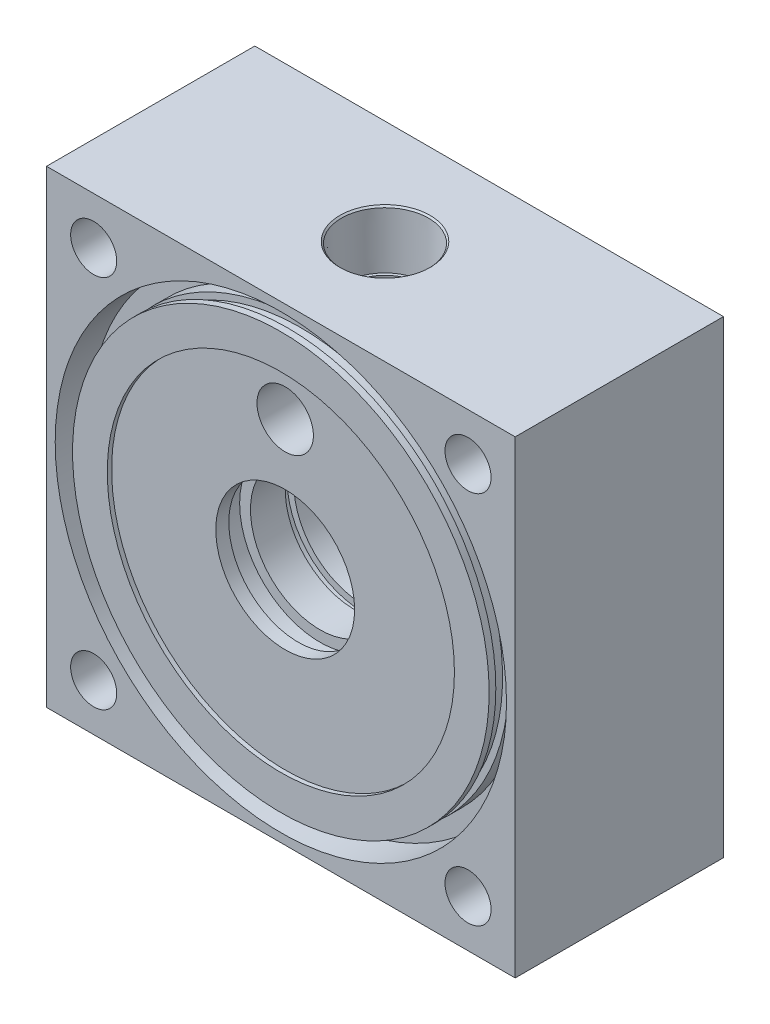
SolidWorks part; units mm, degrees
ref_plane "Front Plane" through (0, 0, 0) normal (0, 0, 1) x (1, 0, 0)
ref_plane "Top Plane" through (0, 0, 0) normal (0, 1, 0) x (1, 0, 0)
ref_plane "Right Plane" through (0, 0, 0) normal (1, 0, 0) x (0, 0, -1)
sketch "Sketch1" plane through (0, 0, 0) normal (0, 0, 1) x (1, 0, 0)
  line L0 (-42.8625, 42.8625) -> (42.8625, -42.8625) construction
  line L1 (-42.8625, -42.8625) -> (42.8625, -42.8625)
  line L2 (-42.8625, -42.8625) -> (-42.8625, 42.8625)
  line L3 (-42.8625, 42.8625) -> (42.8625, 42.8625)
  line L4 (42.8625, -42.8625) -> (42.8625, 42.8625)
  dimension "D2" = 85.725
extrude "Extrude1" add sketch "Sketch1" along normal blind 38.1
sketch "Sketch2" plane through (0, 0, 38.1) normal (0, 0, 1) x (1, 0, 0)
  circle A0 centre (0, 0) radius 38.1
  circle A1 centre (0, 0) radius 41.275
  dimension "D1" = 76.2
  dimension "D2" = 3.175
extrude "Cut-Extrude1" cut sketch "Sketch2" against normal blind 6.35
sketch "Sketch3" plane through (0, 0, 38.1) normal (0, 0, 1) x (1, 0, 0)
  line L0 (-42.8625, -42.8625) -> (42.8625, 42.8625) construction
  line L1 (-42.8625, 42.8625) -> (42.8625, -42.8625) construction
  circle A0 centre (32.8341, 32.8341) radius 4.3656
  circle A1 centre (-32.8341, 32.8341) radius 4.3656
  circle A2 centre (-32.8341, -32.8341) radius 4.3656
  circle A3 centre (32.8341, -32.8341) radius 4.3656
  circle A4 centre (0, 0) radius 46.4344 construction
  circle A5 centre (0, 0) radius 41.275 construction
  dimension "D1" = 8.7312
  dimension "D2" = 5.1594
hole_wizard "3/8 NPT Tapped Hole1" positions "Sketch5" profile "Sketch4" size "3/8" standard "Ansi Inch"
sketch "Sketch5" plane through (0, 42.8625, 0) normal (0, 1, 0) x (-1, 0, 0)
  line L0 (-42.8625, 0) -> (42.8625, 0) construction
  line L1 (42.8625, 38.1) -> (42.8625, 0) construction
  point P0 (0, 19.05)
  point P4 (0, 0)
  point P7 (42.8625, 19.05)
sketch "Sketch4" plane through (0, 42.8625, 19.05) normal (1, 0, 0) x (0, 0, 1)
  line L0 (0, 0) -> (0, 23.3386)
  line L1 (7.1374, 19.05) -> (0, 23.3386)
  line L2 (-7.1374, 19.05) -> (0, 23.3386) construction
  line L3 (7.1374, 19.05) -> (7.1374, 10.414)
  line L4 (7.1374, 10.414) -> (7.6624, 10.414)
  line L5 (7.6624, 10.414) -> (7.9655, 0.2895)
  line L6 (7.9655, 0.2895) -> (8.255, 0)
  line L7 (8.255, 0) -> (0, 0)
  line L8 (0, -6.35) -> (0, 107.95) construction
  line L9 (-7.9655, 0.2895) -> (-8.255, 0) construction
  line L11 (-7.1374, 10.414) -> (-7.6624, 10.414) construction
  line L12 (-7.6624, 10.414) -> (-7.9655, 0.2895) construction
  dimension "Tap Drill Dia." = 14.2748
  dimension "Tap Drill Depth" = 19.05
  dimension "Thread Dia." = 15.9311
  dimension "Thread Angle" = 3.43
  dimension "Thread Depth" = 10.414
  dimension "C'Sink Dia." = 16.51
  dimension "C'Sink Angle" = 90
  dimension "Drill Angle" = 118
sketch "Sketch9" plane through (0, 0, 38.1) normal (0, 0, 1) x (1, 0, 0)
  circle A1 centre (0, 0) radius 31.75
  circle A2 centre (0, 0) radius 38.1 construction
  dimension "D1" = 6.35
extrude "Cut-Extrude3" cut sketch "Sketch9" against normal blind 0.7937
sketch "Sketch10" plane through (0, 0, 38.1) normal (0, 0, 1) x (1, 0, 0)
  circle A0 centre (0, 0) radius 12.7
  dimension "D1" = 25.4
extrude "Cut-Extrude4" cut sketch "Sketch10" against normal through all
sketch "Sketch12" plane through (0, 0, 0) normal (-1, 0, 0) x (0, 0, 1)
  line L2 (38.1, 23.8125) -> (38.1, 18.6532)
  line L3 (38.1, 18.6532) -> (9.525, 18.6532)
  line L4 (9.525, 18.6532) -> (9.525, 20.6375)
  line L7 (9.525, 20.6375) -> (0, 20.6375)
  line L10 (0, 20.6375) -> (0, 23.8125)
  line L12 (0, 23.8125) -> (38.1, 23.8125)
  line L13 (38.1, 23.8125) -> (48.6225, 23.8125) construction
  line L14 (38.1, -42.8625) -> (38.1, 42.8625) construction
  line L16 (0, -42.8625) -> (0, 42.8625) construction
  dimension "D1" = 5.1593
  dimension "D2" = 28.575
  dimension "D5" = 90
  dimension "D7" = 6.35
  dimension "D8" = 23.8125
revolve "Cut-Revolve1" cut sketch "Sketch12" angle 360 about L13
sketch "Sketch13" plane through (0, 0, 0) normal (1, 0, 0) x (0, 0, -1)
  line L0 (-36.8808, 38.1) -> (-36.8808, 36.957)
  line L1 (-31.75, 38.1) -> (-38.1, 38.1) construction
  line L2 (-36.8808, 36.957) -> (-34.4996, 36.957)
  line L3 (-34.4996, 36.957) -> (-34.4996, 38.1)
  line L4 (-34.4996, 38.1) -> (-36.8808, 38.1)
  line L5 (-38.1, 38.1) -> (-38.1, -38.1) construction
  line L6 (0, 0) -> (-36.8808, 0) construction
  dimension "D1" = 1.2192
  dimension "D2" = 1.143
  dimension "D3" = 2.3813
revolve "Cut-Revolve2" cut sketch "Sketch13" angle 360 about L6
sketch "Sketch14" plane through (0, 0, 0) normal (1, 0, 0) x (0, 0, -1)
  line L0 (-34.925, 12.7) -> (-34.925, 14.6844)
  line L1 (0, 12.7) -> (-37.3062, 12.7) construction
  line L2 (-34.925, 14.6844) -> (-30.9562, 14.6844)
  line L3 (-30.9562, 14.6844) -> (-30.9562, 12.7)
  line L4 (-30.9562, 12.7) -> (-34.925, 12.7)
  line L5 (-24.6062, 12.7) -> (-24.6062, 13.9192)
  line L6 (-24.6062, 13.9192) -> (-23.0187, 13.9192)
  line L7 (-23.0187, 13.9192) -> (-23.0187, 12.7)
  line L8 (-23.0187, 12.7) -> (-24.6062, 12.7)
  line L9 (-37.3062, 12.7) -> (-37.3062, -12.7) construction
  line L11 (0, 0) -> (-5.1404, 0) construction
  dimension "D1" = 2.3813
  dimension "D2" = 1.9844
  dimension "D3" = 3.9688
  dimension "D4" = 6.35
  dimension "D5" = 1.5875
  dimension "D6" = 1.2192
revolve "Cut-Revolve3" cut sketch "Sketch14" angle 360 about L11
sketch "Sketch15" plane through (0, 0, 0) normal (0, 0, -1) x (-1, 0, 0)
  circle A0 centre (0, 0) radius 14.6844
  dimension "D1" = 29.3687
extrude "Extrude2" cut sketch "Sketch15" against normal blind 19.05
hole_wizard "1-3/8-6 Tapped Hole3" positions "Sketch17" profile "Sketch16" tap size "1-3/8-6" standard "Example Inch"
sketch "Sketch17" plane through (0, 0, 0) normal (0, 0, -1) x (-1, 0, 0)
  point P0 (0, 0)
sketch "Sketch16" plane through (0, 0, 0) normal (1, 0, 0) x (0, 1, 0)
  line L0 (0, 0) -> (0, 25.1756)
  line L1 (0, 25.1756) -> (15.4788, 15.875)
  line L2 (15.4788, 15.875) -> (15.4788, 0)
  line L5 (15.4788, 0) -> (0, 0)
  line L10 (0, 25.1756) -> (-15.4788, 15.875) construction
  line L11 (0, -6.35) -> (0, 107.95) construction
  dimension "Tap Drill Dia." = 30.9575
  dimension "Tap Drill Depth" = 15.875
  dimension "Drill Angle" = 118
hole_wizard "5/16 Clearance Hole1" positions "Sketch19" profile "Sketch18" hole size "5/16" standard "Example Inch"
sketch "Sketch19" plane through (0, 0, 38.1) normal (0, 0, 1) x (1, 0, 0)
  line L0 (42.8625, 42.8625) -> (-42.8625, -42.8625) construction
  line L2 (-42.8625, 42.8625) -> (42.8625, -42.8625) construction
  circle A0 centre (0, 0) radius 48.4187 construction
  circle A1 centre (0, 0) radius 41.275 construction
  point P0 (-34.2372, 34.2372)
  point P1 (-34.2372, -34.2372)
  point P3 (34.2372, -34.2372)
  point P5 (34.2372, 34.2372)
  dimension "D1" = 7.1437
sketch "Sketch18" plane through (-34.2372, 34.2372, 38.1) normal (1, 0, 0) x (0, -1, 0)
  line L0 (0, 0) -> (0, 38.1)
  line L1 (0, 38.1) -> (4.2164, 38.1)
  line L2 (4.2164, 38.1) -> (4.2164, 0)
  line L5 (4.2164, 0) -> (0, 0)
  line L11 (0, -6.35) -> (0, 107.95) construction
  dimension "Thru Hole Dia." = 8.4328
  dimension "Thru Hole Depth" = 38.1
hole_wizard "3/8-16 Tapped Hole1" positions "Sketch21" profile "Sketch20" tap size "3/8-16" standard "Example Inch"
sketch "Sketch21" plane through (-42.8625, 0, 0) normal (-1, 0, 0) x (0, 0, 1)
  line L0 (0, 0) -> (27.3144, 0) construction
  line L1 (0, 42.8625) -> (0, -42.8625) construction
  line L3 (38.1, -42.8625) -> (0, -42.8625) construction
  point P0 (19.05, -22.225)
  point P1 (19.05, 22.225)
  point P12 (19.05, -42.8625)
  dimension "D1" = 44.45
sketch "Sketch20" plane through (-42.8625, -22.225, 19.05) normal (0, 1, 0) x (0, 0, 1)
  line L0 (0, 0) -> (0, 29.3849)
  line L1 (0, 29.3849) -> (3.9687, 27.0002)
  line L2 (3.9687, 27.0002) -> (3.9687, 0)
  line L5 (3.9687, 0) -> (0, 0)
  line L10 (0, 29.3849) -> (-3.9688, 27.0002) construction
  line L11 (0, -6.35) -> (0, 107.95) construction
  dimension "Tap Drill Dia." = 7.9375
  dimension "Tap Drill Depth" = 27.0002
  dimension "Drill Angle" = 118
